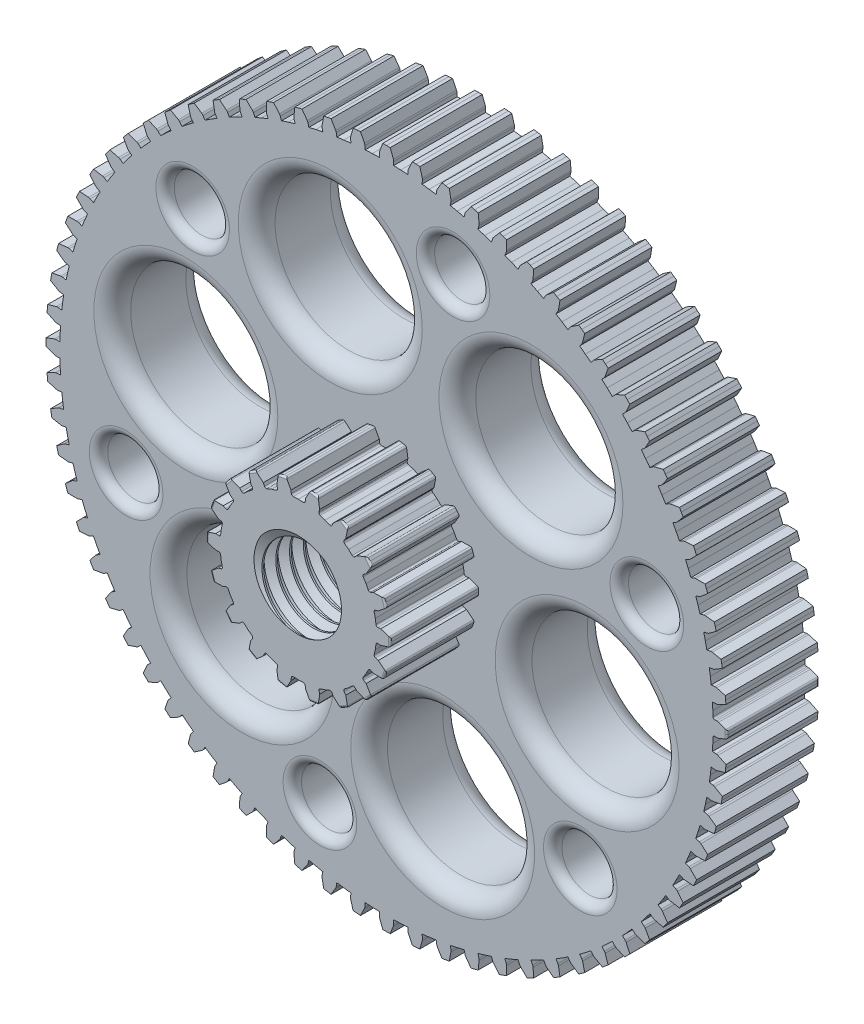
SolidWorks part; units mm, degrees
ref_plane "Front Plane" through (0, 0, 0) normal (0, 0, 1) x (1, 0, 0)
ref_plane "Top Plane" through (0, 0, 0) normal (0, 1, 0) x (1, 0, 0)
ref_plane "Right Plane" through (0, 0, 0) normal (1, 0, 0) x (0, 0, -1)
imported_body "Gear22-1-solid1"
imported_body "Gear12-1-solid1"
sketch "Esquisse1" plane through (0, 0, 10) normal (0, 0, 1) x (1, 0, 0)
  circle A0 centre (15.6984, 16.1186) radius 8
  circle A1 centre (21.8083, -5.536) radius 8
  circle A2 centre (6.1099, -21.6545) radius 8
  circle A3 centre (-15.6984, -16.1186) radius 8
  circle A4 centre (-21.8083, 5.536) radius 8
  circle A5 centre (-6.1099, 21.6545) radius 8
  point P15 (0, 0)
  dimension "D1" = 16
  dimension "D2" = 22.5
  dimension "D3" = 6
extrude "Enlèv. mat.-Extru.2" cut sketch "Esquisse1" against normal through all
sketch "Esquisse15" plane through (0, 0, 9.5894) normal (0, 0, -1) x (-1, 0, 0)
  circle A0 centre (0, 0) radius 4.25 construction
  circle A1 centre (0, 0) radius 4.25
extrude "Boss.-Extru.1" add sketch "Esquisse15" along normal through all
sketch "Esquisse16" plane through (0, 0, 9.5894) normal (0, 0, 1) x (1, 0, 0)
  circle A1 centre (0, 0) radius 4.25
  circle A2 centre (0, 0) radius 4.25
  dimension "D1" = 0
extrude "Boss.-Extru.3" add sketch "Esquisse16" along normal through all
sketch "Esquisse17" plane through (0, 0, 10) normal (0, 0, 1) x (1, 0, 0)
  line L0 (-15.6984, -16.1186) -> (-21.8083, 5.536) construction
  line L1 (-21.8083, 5.536) -> (-18.7534, -5.2913) construction
  line L2 (0, 0) -> (-18.7534, -5.2913) construction
  line L3 (-18.7534, -5.2913) -> (-37.8447, -10.678) construction
  line L4 (0, 0) -> (-28.2991, -7.9847) construction
  circle A0 centre (-28.2991, -7.9847) radius 3
  circle A1 centre (-21.0644, 20.5154) radius 3
  circle A2 centre (7.2346, 28.5) radius 3
  circle A3 centre (28.2991, 7.9847) radius 3
  circle A4 centre (21.0644, -20.5154) radius 3
  circle A5 centre (-7.2346, -28.5) radius 3
  dimension "D1" = 6
  dimension "D3" = 29.4039
  dimension "D2" = 6
extrude "Enlèv. mat.-Extru.3" cut sketch "Esquisse17" against normal blind 10
sketch "Esquisse18" plane through (0, 0, 0) normal (0, 0, -1) x (-1, 0, 0)
  circle A0 centre (0, 0) radius 4.25
  dimension "D1" = 8.5
extrude "Enlèv. mat.-Extru.4" cut sketch "Esquisse18" against normal blind 23
thread "Filetage1" pitch 1.5 start angle 0, offset 4, length 30, pitch 1.5, diameter 8.5
ref_plane "Plan1" through (-4.25, 0, 23.5894) normal (0, -1, 0) x (-1, 0, 0)
sketch "Profil de filetage1" plane through (-4.25, 0, 23.5894) normal (0, -1, 0) x (-1, 0, 0)
  line L0 (0, 0) -> (0, 1.5) construction
  line L11 (0, 1.3125) -> (0, 0)
  line L12 (0, 0) -> (0.8119, 0.4688)
  line L13 (0.8119, 0.4688) -> (0.8119, 0.8438)
  line L15 (0.8119, 0.8438) -> (0, 1.3125)
  line L17 (0.8119, 0.6563) -> (0, 0.6563) construction
  point P3 (0, 0)
  dimension "Pitch" = 1.5
  dimension "Profile_Angle" = 60
  dimension "Profile_Land" = 0.375
  dimension "Profile_Height" = 0.8119
fillet "Congé1" radius 2 12 edges at (23.6984, 16.1186, 10) (23.6984, 16.1186, 0) (1.8901, 21.6545, 10) (1.8901, 21.6545, 0) (29.8083, -5.536, 10) (29.8083, -5.536, 0) (-13.8083, 5.536, 0) (14.1099, -21.6545, 0) (-7.6984, -16.1186, 0) (14.1099, -21.6545, 10) (-7.6984, -16.1186, 10) (-13.8083, 5.536, 10)
fillet "Congé2" radius 1 12 edges at (-18.0644, 20.5154, 10) (-18.0644, 20.5154, 0) (10.2346, 28.5, 10) (10.2346, 28.5, 0) (31.2991, 7.9847, 10) (31.2991, 7.9847, 0) (24.0644, -20.5154, 10) (24.0644, -20.5154, 0) (-25.2991, -7.9847, 10) (-25.2991, -7.9847, 0) (-4.2346, -28.5, 0) (-4.2346, -28.5, 10)
